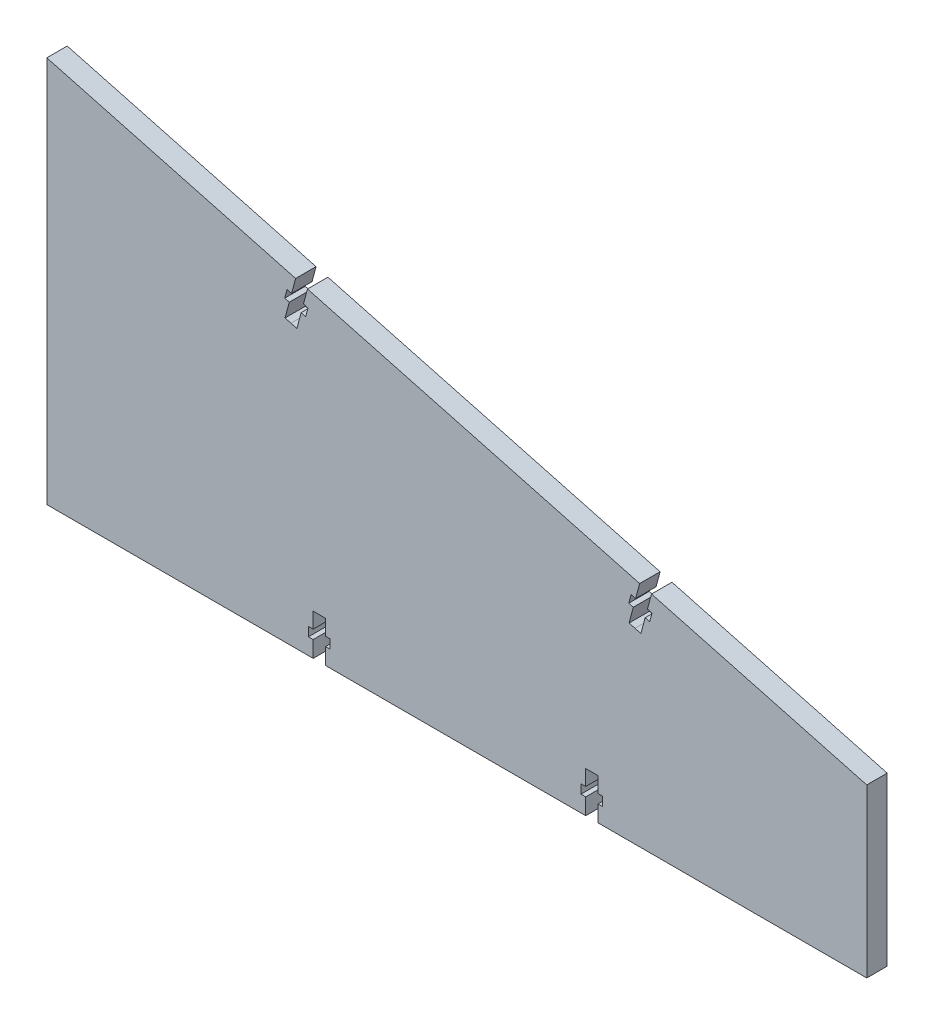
SolidWorks part; units mm, degrees
ref_plane "Front Plane" through (0, 0, 0) normal (0, 0, 1) x (1, 0, 0)
ref_plane "Top Plane" through (0, 0, 0) normal (0, 1, 0) x (1, 0, 0)
ref_plane "Right Plane" through (0, 0, 0) normal (1, 0, 0) x (0, 0, -1)
ref_plane "Plane1" through (0, 0, 5) normal (0, 0, 1) x (1, 0, 0)
sketch "Sketch1" plane through (0, 0, 5) normal (0, 0, 1) x (1, 0, 0)
  line L0 (10.6706, -39.7791) -> (10.6706, -41.9785)
  line L1 (10.6706, -41.9785) -> (9.5209, -41.9785)
  line L2 (9.5209, -41.9785) -> (9.5209, -45.9775)
  line L3 (9.5209, -45.9775) -> (75.2497, -45.9775)
  line L4 (75.2497, -45.9775) -> (75.2497, -5.0837)
  line L5 (-64.4231, 32.3416) -> (-65.4066, 28.6711)
  line L6 (-125.2764, 48.6473) -> (-125.2764, -45.9775)
  line L7 (-125.2764, -45.9775) -> (-60.1272, -45.9775)
  line L8 (-60.1272, -45.9775) -> (-60.1272, -41.9785)
  line L9 (-60.1272, -41.9785) -> (-61.2768, -41.9785)
  line L10 (-61.2768, -41.9785) -> (-61.2768, -39.7791)
  line L11 (-61.2768, -39.7791) -> (-60.1272, -39.7791)
  line L12 (-60.1272, -39.7791) -> (-60.1272, -35.9801)
  line L13 (-60.1272, -35.9801) -> (-57.128, -35.9801)
  line L14 (-57.128, -35.9801) -> (-57.128, -39.7791)
  line L15 (-57.128, -39.7791) -> (-55.9783, -39.7791)
  line L16 (-55.9783, -39.7791) -> (-55.9783, -41.9785)
  line L17 (-55.9783, -41.9785) -> (-57.128, -41.9785)
  line L18 (-57.128, -41.9785) -> (-57.128, -45.9775)
  line L19 (-57.128, -45.9775) -> (6.5217, -45.9775)
  line L20 (6.5217, -45.9775) -> (6.5217, -41.9785)
  line L21 (6.5217, -41.9785) -> (5.372, -41.9785)
  line L22 (5.372, -41.9785) -> (5.372, -39.7791)
  line L23 (5.372, -39.7791) -> (6.5217, -39.7791)
  line L24 (6.5217, -39.7791) -> (6.5217, -35.9801)
  line L25 (6.5217, -35.9801) -> (9.5209, -35.9801)
  line L26 (9.5209, -35.9801) -> (9.5209, -39.7791)
  line L27 (9.5209, -39.7791) -> (10.6706, -39.7791)
  line L28 (-125.2764, 48.6473) -> (-64.4231, 32.3416)
  line L29 (75.2497, -5.0837) -> (22.6068, 9.022)
  line L30 (-65.4066, 28.6711) -> (-66.5174, 28.9688)
  line L31 (-66.5174, 28.9688) -> (-67.0868, 26.8437)
  line L32 (-67.0868, 26.8437) -> (-65.976, 26.5461)
  line L33 (-65.976, 26.5461) -> (-67.0113, 22.6824)
  line L34 (-67.0113, 22.6824) -> (-65.5624, 22.2941)
  line L35 (-64.4231, 32.3416) -> (-62.9828, 31.9227) construction
  line L36 (-62.9828, 31.9227) -> (-65.5624, 22.2941) construction
  line L37 (-64.1135, 21.906) -> (-65.5624, 22.2941)
  line L38 (-63.0785, 25.7698) -> (-64.1135, 21.906)
  line L39 (-61.9676, 25.4722) -> (-63.0785, 25.7698)
  line L40 (-62.5092, 27.8949) -> (-61.3984, 27.5973)
  line L41 (-61.3984, 27.5973) -> (-61.9676, 25.4722)
  line L42 (-61.526, 31.5654) -> (-62.5092, 27.8949)
  line L43 (-64.4231, 32.3416) -> (22.6068, 9.022) construction
  line L44 (-20.9082, 20.6818) -> (-25.4145, 3.8641) construction
  line L45 (21.6233, 5.3514) -> (22.7341, 5.0538)
  line L46 (22.1647, 2.9288) -> (21.0539, 3.2264)
  line L47 (22.7341, 5.0538) -> (22.1647, 2.9288)
  line L48 (21.0539, 3.2264) -> (20.0186, -0.6373)
  line L49 (20.0186, -0.6373) -> (18.5697, -0.2491)
  line L50 (17.1208, 0.1393) -> (18.5697, -0.2491)
  line L51 (18.1564, 4.0029) -> (17.1208, 0.1393)
  line L52 (17.0456, 4.3006) -> (18.1564, 4.0029)
  line L53 (18.7259, 6.1279) -> (17.6151, 6.4256)
  line L54 (17.6151, 6.4256) -> (17.0456, 4.3006)
  line L55 (19.7097, 9.7983) -> (18.7259, 6.1279)
  line L56 (22.6068, 9.022) -> (21.6233, 5.3514)
  line L57 (-61.526, 31.5654) -> (19.7097, 9.7983)
  dimension "D1" = 207.6
  dimension "D2" = 63
  dimension "D3" = 54.5
extrude "Boss-Extrude1" add sketch "Sketch1" against normal blind 5
